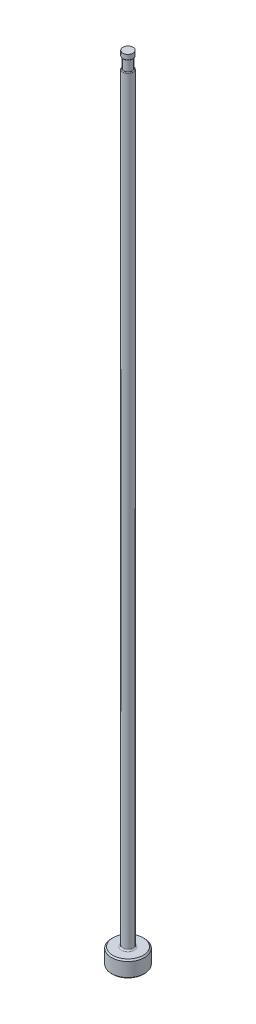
SolidWorks part; units mm, degrees
ref_plane "Front Plane" through (0, 0, 0) normal (0, 0, 1) x (1, 0, 0)
ref_plane "Top Plane" through (0, 0, 0) normal (0, 1, 0) x (1, 0, 0)
ref_plane "Right Plane" through (0, 0, 0) normal (1, 0, 0) x (0, 0, -1)
other "Configuration Table"
sketch "Sketch1" plane through (0, 0, 0) normal (0, 0, 1) x (1, 0, 0)
  line L0 (0, 259.9588) -> (0, -15.1925) construction
  line L1 (0, 0) -> (-3.175, 0)
  line L2 (-3.175, 0) -> (-3.175, 3.175)
  line L3 (-3.175, 3.175) -> (-0.9919, 3.175)
  line L4 (-0.9919, 3.175) -> (-0.9919, 152.4)
  line L5 (-0.9919, 152.4) -> (0, 152.4)
  line L6 (0, 152.4) -> (0, 0)
  dimension "L" = 152.4
  dimension "H" = 6.35
  dimension "T" = 3.175
  dimension "D" = 1.9837
revolve "Revolve1" add sketch "Sketch1" angle 360 about L0
chamfer "Chamfer1" distance 0.254 angle 45 2 edges at (0, 3.175, 3.175) (0, 0, 3.175)
fillet "Fillet1" radius 0.254 1 edges at (0, 3.175, 0.9919)
sketch "Sketch2" plane through (0, 0, 0) normal (0, 0, 1) x (1, 0, 0)
  line L0 (-0.9919, 152.4) -> (-0.9919, 3.429) construction
  line L1 (-0.9919, 151.384) -> (-0.7887, 151.384)
  line L2 (-0.9919, 151.384) -> (-0.9919, 149.352)
  line L3 (-0.9919, 149.352) -> (-0.7887, 149.352)
  line L4 (-0.7887, 151.384) -> (-0.7887, 149.352)
  line L5 (0.9919, 152.4) -> (-0.9919, 152.4) construction
  line L6 (0, 153.4483) -> (0, 147.3282) construction
  dimension "D1" = 2.032
  dimension "N" = 1.016
  dimension "FD" = 0.2032
  dimension "D3" = 1.5773
revolve "Vent Relief" cut sketch "Sketch2" angle 360 about L6
sketch "Sketch3" plane through (0, 0, 0) normal (0, 0, 1) x (1, 0, 0)
  line L0 (-0.7887, 150.368) -> (-0.7887, 86.868)
  line L1 (-0.7887, 151.384) -> (-0.7887, 149.352) construction
  line L2 (-0.9919, 149.352) -> (-0.9919, 3.429) construction
  line L3 (-0.9919, 85.7504) -> (-0.9919, 150.368)
  line L4 (-0.9919, 150.368) -> (-0.7887, 150.368)
  arc A0 (-0.7887, 86.868) -> (-0.9919, 85.7504) centre (-3.9637, 86.868) cw
  dimension "D1" = 3.175
  dimension "D2" = 63.5
extrude "D-Slot" cut sketch "Sketch3" against normal through all both and the other way through all
sketch "Sketch5" plane through (0, 0, 0) normal (0, 0, 1) x (1, 0, 0)
  line L0 (-0.9919, 151.384) -> (0.9919, 151.384) construction
  line L1 (-0.9919, 152.4) -> (-0.9868, 152.4)
  line L2 (-0.9919, 152.4) -> (-0.9919, 151.384)
  line L3 (-0.9919, 151.384) -> (-0.9868, 151.384)
  line L4 (-0.9868, 152.4) -> (-0.9868, 151.384)
  line L5 (0, 152.6877) -> (0, 150.5771) construction
  dimension "VP" = 0.0051
revolve "Vent Diameter" cut sketch "Sketch5" angle 360 about L5
fillet "Fillet2" radius 0.127 2 edges at (0.9919, 149.352, 0) (0, 151.384, 0.9868)
sketch "Pocket Sketch" plane through (0, 0, 0) normal (0, 0, 1) x (1, 0, 0)
  line L0 (-3.5719, 0) -> (-3.5719, 3.2004)
  line L1 (-3.5719, 3.2004) -> (-1.9523, 3.2004)
  line L2 (-1.1903, 3.9624) -> (-1.1903, 22.225)
  line L3 (-1.1903, 22.225) -> (0, 22.225)
  line L4 (0, 22.225) -> (0, 0)
  line L5 (0, 0) -> (-3.5719, 0)
  line L6 (0, 12.6104) -> (0, -2.4989) construction
  line L7 (-3.175, 2.921) -> (-3.175, 0.254) construction
  line L8 (2.921, 3.175) -> (-2.921, 3.175) construction
  line L9 (-0.9919, 85.7504) -> (-0.9919, 3.429) construction
  line L10 (-1.9523, 3.2004) -> (-1.1903, 3.9624)
  point P3 (-1.1903, 3.2004)
  dimension "D1" = 7.1437
  dimension "D2" = 0.3969
  dimension "D3" = 0.0254
  dimension "D4" = 0.1984
  dimension "D5" = 2.3806
  dimension "D6" = 22.225
